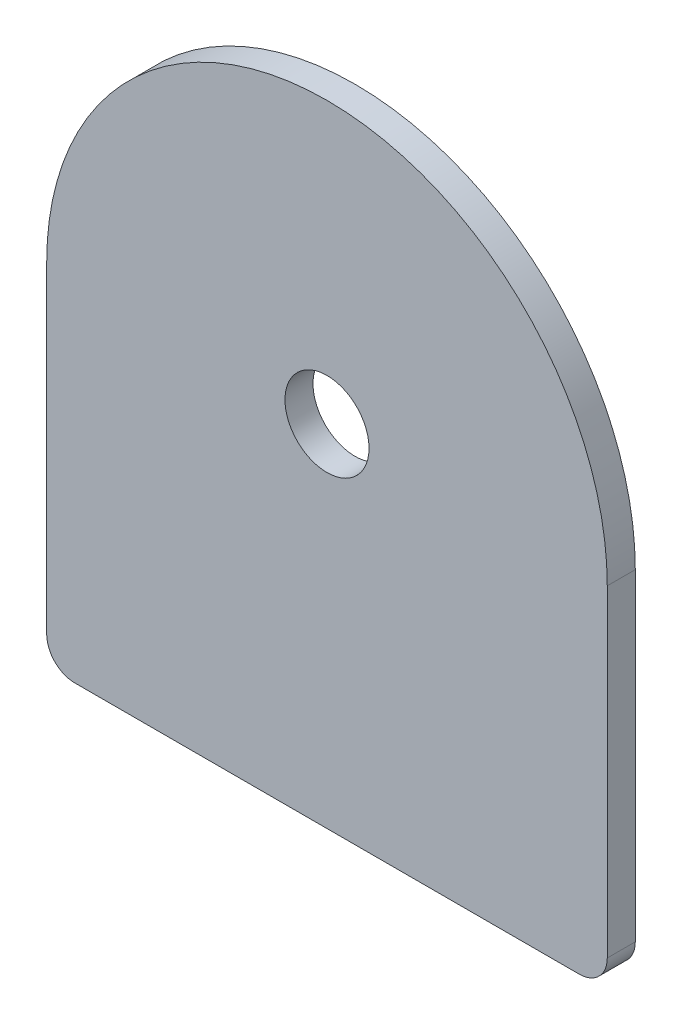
SolidWorks part; units mm, degrees
ref_plane "Plan de face" through (0, 0, 0) normal (0, 0, 1) x (1, 0, 0)
ref_plane "Plan de dessus" through (0, 0, 0) normal (0, 1, 0) x (1, 0, 0)
ref_plane "Plan de droite" through (0, 0, 0) normal (1, 0, 0) x (0, 0, -1)
sketch "Esquisse1" plane through (0, 0, 0) normal (0, 0, 1) x (1, 0, 0)
  line L2 (-20, 0) -> (-20, -23)
  line L3 (-18, -25) -> (18, -25)
  line L4 (20, 0) -> (20, -23)
  arc A0 (20, 0) -> (-20, 0) centre (0, 0) ccw
  circle A1 centre (0, 0) radius 3
  arc A2 (-20, -23) -> (-18, -25) centre (-18, -23) ccw
  arc A3 (18, -25) -> (20, -23) centre (18, -23) ccw
  dimension "D1" = 25
  dimension "D2" = 2
extrude "Extrusion1" add sketch "Esquisse1" along normal blind 2
